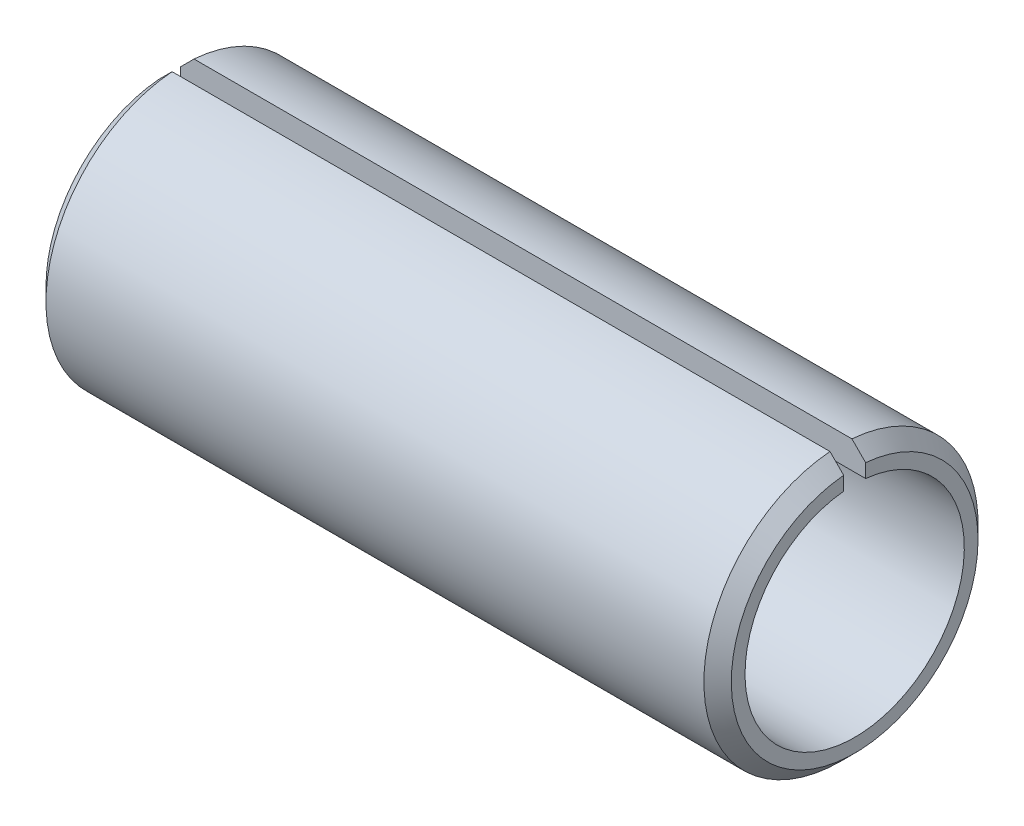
SolidWorks part; units mm, degrees
ref_plane "Plan1" through (0, 0, 0) normal (0, 0, 1) x (1, 0, 0)
ref_plane "Plan2" through (0, 0, 0) normal (0, 1, 0) x (1, 0, 0)
ref_plane "Plan3" through (0, 0, 0) normal (1, 0, 0) x (0, 0, -1)
sketch "Esquisse1" plane through (0, 0, 0) normal (0, 0, 1) x (1, 0, 0)
  line L0 (0, 1.6) -> (0, 1.8)
  line L1 (0, 1.6) -> (10, 1.6)
  line L2 (10, 1.6) -> (10, 1.8)
  line L3 (10, 1.8) -> (9.8, 2)
  line L4 (9.8, 2) -> (0.2, 2)
  line L5 (0.2, 2) -> (0, 1.8)
  line L6 (0, 0) -> (10, 0) construction
  dimension "D1" = 10
  dimension "D2" = 2
  dimension "D3" = 0.4
  dimension "D4" = 45
  dimension "D5" = 45
  dimension "D6" = 0.2
revolve "Base-Révolution" add sketch "Esquisse1" angle 360 about L6
sketch "Esquisse2" plane through (0, 0, 0) normal (1, 0, 0) x (0, 0, -1)
  line L0 (0, 0) -> (0, 2) construction
  line L1 (0.16, 1.9936) -> (0.16, 1.592)
  line L2 (-0.16, 1.9936) -> (-0.16, 1.592)
  circle A0 centre (0, 0) radius 2 construction
  circle A1 centre (0, 0) radius 1.6 construction
  arc A2 (0.16, 1.592) -> (-0.16, 1.592) centre (0, 0) ccw
  arc A3 (0.16, 1.9936) -> (-0.16, 1.9936) centre (0, 0) ccw
  dimension "D1" = 0.16
extrude "Enlèv. mat.-Extru.2" cut sketch "Esquisse2" along normal through all
equation "\"D6@Esquisse1\"=\"D2@Esquisse1\"/10"
equation "\"D1@Esquisse2\"=\"D3@Esquisse1\"/2.5"
